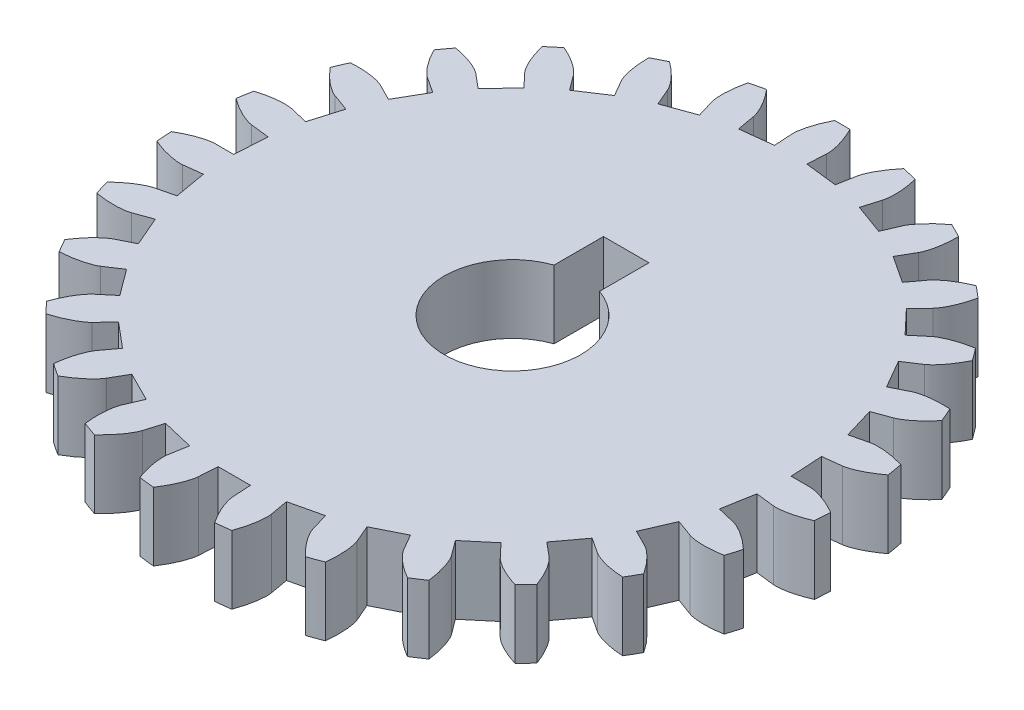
SolidWorks part; units mm, degrees
ref_plane "Front Plane" through (0, 0, 0) normal (0, 0, 1) x (1, 0, 0)
ref_plane "Top Plane" through (0, 0, 0) normal (0, 1, 0) x (1, 0, 0)
ref_plane "Right Plane" through (0, 0, 0) normal (1, 0, 0) x (0, 0, -1)
sketch "Sketch1" plane through (0, 0, 0) normal (0, 1, 0) x (1, 0, 0)
  line L0 (0, 0) -> (0, 6.535) construction
  line L1 (0, 0) -> (-6.535, 0) construction
  line L2 (0, 0) -> (-7.2377, -0.4216) construction
  line L3 (0, 0) -> (-6.4908, -0.7587) construction
  line L4 (0, 0) -> (-6.3588, -1.5071) construction
  circle A0 centre (0, 0) radius 6.75 construction
  circle A1 centre (0, 0) radius 6.535 construction
  circle A2 centre (0, 0) radius 6.125 construction
  circle A3 centre (0, 0) radius 7.25 construction
  spline S0 degree 4 poles (-6.535, 0) (-6.5438, 0) (-6.5686, -0.0009) (-6.6152, -0.0062) (-6.6906, -0.0199) (-6.7852, -0.0447) (-6.9051, -0.0851) (-7.043, -0.143) (-7.1899, -0.2174) (-7.3443, -0.3094) (-7.4929, -0.4109) (-7.6355, -0.5204) (-7.7723, -0.6373) (-7.9311, -0.7868) (-8.1118, -0.9784) (-8.3076, -1.2163) (-8.5107, -1.5059) (-8.6957, -1.8139) (-8.8595, -2.1352) (-9.0024, -2.4639) (-9.1252, -2.8045) (-9.2281, -3.145) (-9.3121, -3.5021) (-9.3686, -3.7998) (-9.4066, -4.0848) (-9.4341, -4.3232) (-9.4546, -4.636) (-9.462, -4.8365) (-9.4629, -5.1432) (-9.4571, -5.2576) (-9.4544, -5.3468) knots 0 0 0 0 0 0.005377 0.015084 0.028532 0.04661 0.064855 0.092111 0.119476 0.146842 0.174209 0.201575 0.228941 0.256307 0.307035 0.361767 0.4165 0.471232 0.525964 0.580697 0.635429 0.690161 0.744894 0.799626 0.826992 0.854358 0.909091 0.954545 1 1 1 1 1 construction
  spline S1 degree 4 poles (-6.535, 0) (-6.5438, 0) (-6.5686, -0.0009) (-6.6152, -0.0062) (-6.6906, -0.0199) (-6.7852, -0.0447) (-6.9051, -0.0851) (-7.043, -0.143) (-7.1899, -0.2174) (-7.3443, -0.3094) (-7.4929, -0.4109) (-7.6355, -0.5204) (-7.7723, -0.6373) (-7.9311, -0.7868) (-8.1118, -0.9784) (-8.3076, -1.2163) (-8.5107, -1.5059) (-8.6957, -1.8139) (-8.8595, -2.1352) (-9.0024, -2.4639) (-9.1252, -2.8045) (-9.2281, -3.145) (-9.3121, -3.5021) (-9.3686, -3.7998) (-9.4066, -4.0848) (-9.4341, -4.3232) (-9.4486, -4.5442) (-9.4547, -4.6645) (-9.4575, -4.7462) knots 0 0 0 0 0 0.005377 0.015084 0.028532 0.04661 0.064855 0.092111 0.119476 0.146842 0.174209 0.201575 0.228941 0.256307 0.307035 0.361767 0.4165 0.471232 0.525964 0.580697 0.635429 0.690161 0.744894 0.799626 0.826992 0.854358 0.909091 0.909091 0.909091 0.909091 0.909091
  dimension "D1" = 14.5
  dimension "D2" = 13.5
  dimension "D3" = 13.07
  dimension "D4" = 12.25
  dimension "D5" = 6.535
  dimension "D6" = 3.333
  dimension "D7" = 6.667
  dimension "D8" = 13.333
sketch "Sketch2" plane through (0, 0, 0) normal (0, 1, 0) x (1, 0, 0)
  line L0 (0, 0) -> (-7.2377, -0.4216) construction
  line L1 (0, 0) -> (-7.2377, -0.4216) construction
  line L2 (0, 0) -> (-6.4908, -0.7587) construction
  line L3 (0, 0) -> (-6.535, 0) construction
  line L4 (0, 0) -> (-6.3588, -1.5071) construction
  line L5 (0, 0) -> (-6.4908, -0.7587) construction
  line L6 (0, 0) -> (-6.535, 0) construction
  line L7 (0, 0) -> (-6.3588, -1.5071) construction
  line L8 (-6.4908, -0.7587) -> (-6.0836, -0.7111)
  line L9 (-6.0836, -0.7111) -> (-5.9599, -1.4125)
  line L10 (-5.9599, -1.4125) -> (-6.3588, -1.5071) construction
  line L11 (-5.9599, -1.4125) -> (-1.4596, -0.3459)
  line L12 (-6.535, 0) -> (-1.5, 0)
  circle A0 centre (0, 0) radius 6.125 construction
  circle A1 centre (0, 0) radius 6.535 construction
  circle A2 centre (0, 0) radius 6.75 construction
  circle A3 centre (0, 0) radius 7.25 construction
  circle A4 centre (0, 0) radius 6.125 construction
  circle A5 centre (0, 0) radius 6.535 construction
  circle A6 centre (0, 0) radius 6.75 construction
  circle A7 centre (0, 0) radius 7.25 construction
  arc A8 (-7.2259, -0.5909) -> (-7.2456, -0.2519) centre (0, 0) cw
  circle A11 centre (0, 0) radius 1.5 construction
  arc A12 (-1.5, 0) -> (-1.4596, -0.3459) centre (0, 0) ccw
  spline S0 degree 4 poles (-37.1826, -999.4945) (-5.0166, -19.3405) (-5.2547, -0.3967) (-6.0081, 0.1042) (-6.6906, -0.0199) (-6.7852, -0.0447) (-6.9051, -0.0851) (-7.043, -0.143) (-7.1899, -0.2174) (-7.3443, -0.3094) (-7.4929, -0.4109) (-7.6355, -0.5204) (-7.7723, -0.6373) (-7.9311, -0.7868) (-8.1118, -0.9784) (-8.3076, -1.2163) (-8.5107, -1.5059) (-8.6957, -1.8139) (-8.8595, -2.1352) (-9.0024, -2.4639) (-9.1252, -2.8045) (-9.2281, -3.145) (-9.3121, -3.5021) (-9.3686, -3.7998) (-9.4066, -4.0848) (-9.5414, -5.2538) (-9.4875, -9.2591) (-7.4932, 39.0614) (-41.6633, -1004.1885) knots -0.375533 -0.375533 -0.375533 -0.375533 -0.375533 0.005377 0.015084 0.028532 0.04661 0.064855 0.092111 0.119476 0.146842 0.174209 0.201575 0.228941 0.256307 0.307035 0.361767 0.4165 0.471232 0.525964 0.580697 0.635429 0.690161 0.744894 0.799626 0.826992 0.854358 1.549923 1.549923 1.549923 1.549923 1.549923 only from (-6.535, 0) to (-9.4575, -4.7462) construction
  spline S1 degree 4 poles (-6.535, 0) (-6.5438, 0) (-6.5686, -0.0009) (-6.6152, -0.0062) (-6.6906, -0.0199) (-6.7852, -0.0447) (-6.9051, -0.0851) (-7.0373, -0.1407) (-7.139, -0.1917) (-7.212, -0.2324) (-7.2456, -0.2519) knots 0 0 0 0 0 0.005377 0.015084 0.028532 0.04661 0.064855 0.092111 0.115778 0.115778 0.115778 0.115778 0.115778
  spline S2 degree 4 poles (-6.4908, -0.7587) (-6.4996, -0.7597) (-6.5243, -0.7617) (-6.5712, -0.7618) (-6.6476, -0.7569) (-6.7445, -0.7433) (-6.8683, -0.7171) (-7.0061, -0.6773) (-7.1129, -0.6384) (-7.1902, -0.6065) (-7.2259, -0.5909) knots 0 0 0 0 0 0.005377 0.015084 0.028532 0.04661 0.064855 0.092111 0.115778 0.115778 0.115778 0.115778 0.115778
  point P21 (-6.0836, -0.7111)
  point P24 (-5.9599, -1.4125)
  dimension "D2" = 3
extrude "Boss-Extrude1" add sketch "Sketch2" along normal blind 1.5
pattern_circular "CirPattern1" count 27 over 360 of "Boss-Extrude1"
sketch "Sketch3" plane through (0, 1.5, 0) normal (0, 1, 0) x (1, 0, 0)
  line L1 (0.5, 0.5) -> (-0.5, 0.5)
  line L2 (0.5, 0.5) -> (0.5, 2.5)
  line L3 (0.5, 2.5) -> (-0.5, 2.5)
  line L4 (-0.5, 0.5) -> (-0.5, 2.5)
  line L5 (0.5, 0.5) -> (-0.5, 2.5) construction
  line L6 (0.5, 2.5) -> (-0.5, 0.5) construction
  circle A0 centre (0, 0) radius 1.5 construction
  point P0 (0, 1.5)
  dimension "D1" = 2
  dimension "D2" = 1
extrude "Cut-Extrude1" cut sketch "Sketch3" against normal up to surface (1.5 mm away)
equation "\"Module\"= .5"
equation "\"Number of Teeth\" = 27"
equation "\"Pressure Angle\"= 14.5deg"
equation "\"Pitch Diameter\"= \"Number of Teeth\" * \"Module\""
equation "\"Circular Pitch\"= pi * \"Module\""
equation "\"Addendum\"= \"Module\""
equation "\"Dedendum\"= 1.25 * \"Module\""
equation "\"Base Diameter\"= \"Pitch Diameter\" * cos ( \"Pressure Angle\" )"
equation "\"Base Radius\"= \"Base Diameter\" / 2"
equation "\"Width\"= 1.5"
equation "\"Outside Diameter\"= \"Pitch Diameter\" + 2 * \"Addendum\""
equation "\"D1@Sketch1\"=\"Outside Diameter\""
equation "\"D3@Sketch1\"=\"Base Diameter\""
equation "\"Root Diameter\"= \"Pitch Diameter\" - 2 * \"Dedendum\""
equation "\"D4@Sketch1\"=\"Root Diameter\""
equation "\"Tooth Angle\"= 360 / \"Number of Teeth\""
equation "\"D6@Sketch1\"=\"Tooth Angle\"/4"
equation "\"D7@Sketch1\"=\"Tooth Angle\"/2"
equation "\"D8@Sketch1\"=\"Tooth Angle\""
equation "\"D2@Sketch1\" = \"Pitch Diameter\""
equation "\"Shaft Diameter\"= 3"
equation "\"D1@CirPattern1\" = \"Number of Teeth\""
equation "\"D2@Sketch2\"= \"Shaft Diameter\""
equation "\"D1@Boss-Extrude1\" = \"Width\""
